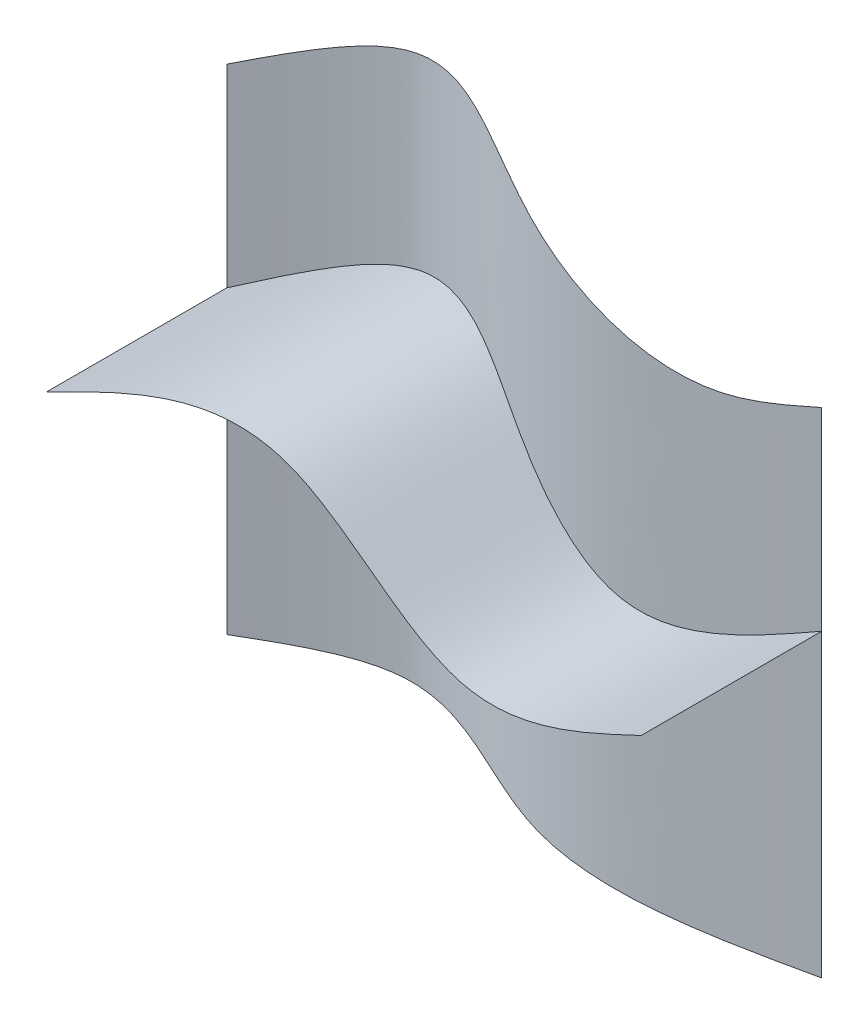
SolidWorks part; units mm, degrees
ref_plane "Front" through (0, 0, 0) normal (0, 0, 1) x (1, 0, 0)
ref_plane "Top" through (0, 0, 0) normal (0, 1, 0) x (1, 0, 0)
ref_plane "Right" through (0, 0, 0) normal (1, 0, 0) x (0, 0, -1)
sketch "Sketch1" plane through (0, 0, 0) normal (0, 0, 1) x (1, 0, 0)
  spline_without_curve S0
surface "Surface-Extrude1" sketch "Sketch1" parameters "D1"=101
sketch "Sketch2" plane through (0, 0, 0) normal (0, 1, 0) x (1, 0, 0)
  line L0 (-79.4813, -50.5) -> (-79.4813, 50.5) construction
  line L1 (86.9618, 50.5) -> (86.9618, -50.5) construction
  spline_without_curve S0
surface "Surface-Extrude2" sketch "Sketch2" parameters "D1"=168.0366
sketch "Sketch3" plane through (0, 0, 0) normal (0, 0, 1) x (1, 0, 0)
  line L0 (-79.4813, 84.0183) -> (-79.4813, -84.0183) construction
  spline_without_curve S0
surface "Surface-Trim9"
sketch "Sketch4" plane through (0, 0, 0) normal (0, 1, 0) x (1, 0, 0)
  line L1 (1.5801, -14.851) -> (95.9667, -14.851)
  line L2 (1.5801, -14.851) -> (1.5801, -54.2735)
  line L3 (1.5801, -54.2735) -> (95.9667, -54.2735)
  line L4 (95.9667, -14.851) -> (95.9667, -54.2735)
surface "Surface-Trim11"
surface "Surface-Untrim1"
surface "Surface-Trim12"
